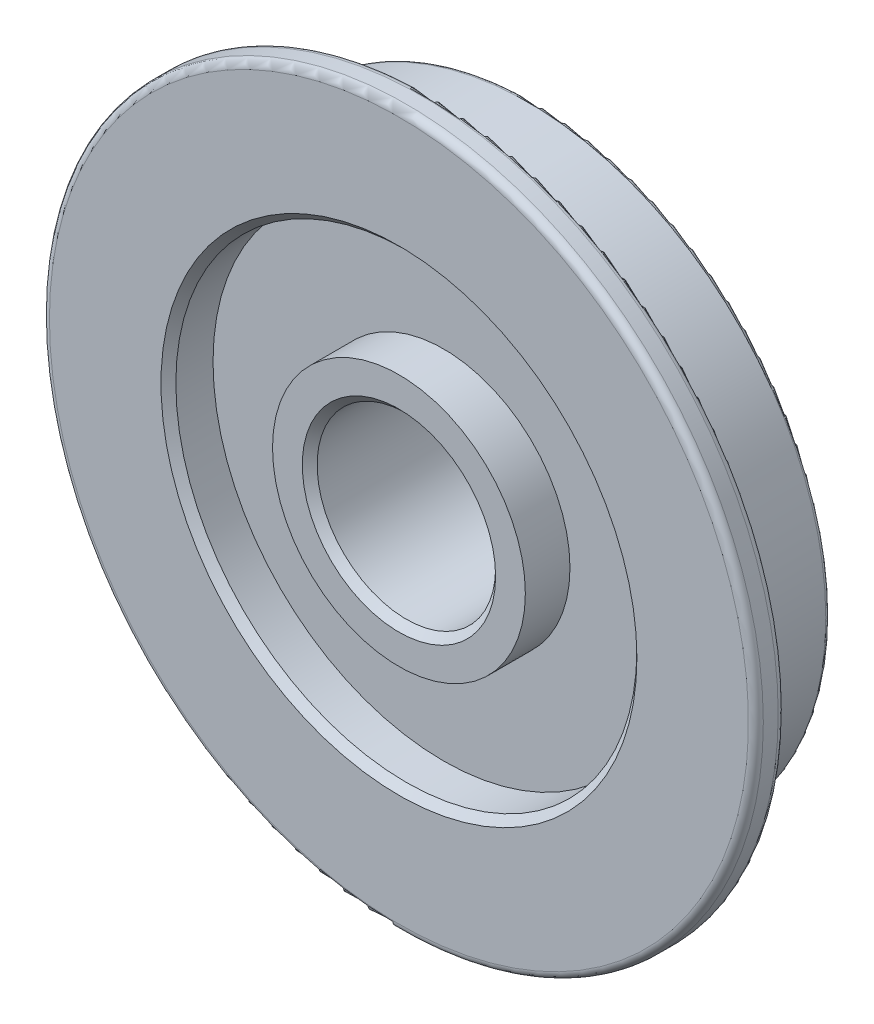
SolidWorks part; units mm, degrees
ref_plane "Plan1" through (0, 0, 0) normal (0, 0, 1) x (1, 0, 0)
ref_plane "Plan2" through (0, 0, 0) normal (0, 1, 0) x (1, 0, 0)
ref_plane "Plan3" through (0, 0, 0) normal (1, 0, 0) x (0, 0, -1)
sketch "Esquisse1" plane through (0, 0, 0) normal (1, 0, 0) x (0, 0, -1)
  line L0 (-50, 0) -> (60, 0) construction
  line L1 (0, 6) -> (0, 8.5)
  line L2 (0, 8.5) -> (3, 8.5)
  line L3 (3, 8.5) -> (3, 15.5)
  line L4 (0, 15.5) -> (3, 15.5)
  line L5 (0, 15.5) -> (0, 24)
  line L7 (0, 24) -> (2, 24)
  line L8 (2, 24) -> (2, 20)
  line L9 (2, 20) -> (9, 20)
  line L10 (9, 20) -> (9, 13.75)
  line L11 (9, 13.75) -> (12, 13.75)
  line L12 (12, 13.75) -> (12, 6)
  line L13 (12, 6) -> (0, 6)
  dimension "D1" = 6
  dimension "D2" = 13.75
  dimension "D3" = 20
  dimension "D4" = 24
  dimension "D5" = 2
  dimension "D6" = 3
  dimension "D7" = 9
  dimension "D8" = 12
  dimension "D9" = 8.5
  dimension "D10" = 15.5
revolve "Base-Révolution" add sketch "Esquisse1" angle 360 about L0
chamfer "Chanfrein1" distance 0.5 angle 45
chamfer "Chanfrein2" distance 0.5 angle 45
fillet "Congé1" radius 0.5
fillet "Congé2" radius 0.3
chamfer "Chanfrein3" distance 2 angle 45
